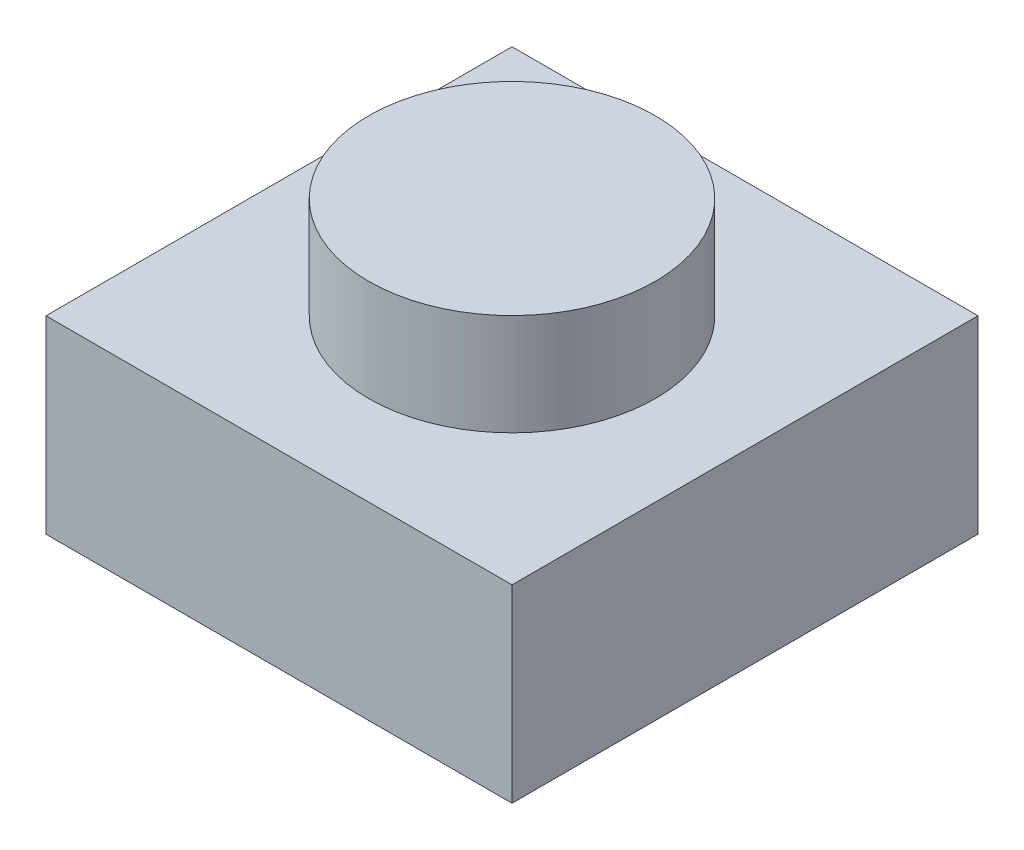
SolidWorks part; units mm, degrees
ref_plane "Front Plane" through (0, 0, 0) normal (0, 0, 1) x (1, 0, 0)
ref_plane "Top Plane" through (0, 0, 0) normal (0, 1, 0) x (1, 0, 0)
ref_plane "Right Plane" through (0, 0, 0) normal (1, 0, 0) x (0, 0, -1)
sketch "Sketch1" plane through (0, 0, 0) normal (0, 1, 0) x (1, 0, 0)
  line L1 (3.9, -3.9) -> (-3.9, -3.9)
  line L2 (3.9, -3.9) -> (3.9, 3.9)
  line L3 (3.9, 3.9) -> (-3.9, 3.9)
  line L4 (-3.9, -3.9) -> (-3.9, 3.9)
  line L5 (3.9, -3.9) -> (-3.9, 3.9) construction
  line L6 (3.9, 3.9) -> (-3.9, -3.9) construction
  point P0 (0, 0)
  dimension "D1" = 7.8
  dimension "D2" = 7.8
extrude "Extrude1" add sketch "Sketch1" along normal blind 3.166
sketch "Sketch2" plane through (0, 3.166, 0) normal (0, 1, 0) x (1, 0, 0)
  circle A0 centre (0, 0) radius 2.4
  dimension "D1" = 4.8
extrude "Extrude2" add sketch "Sketch2" along normal blind 1.7
sketch "Sketch3" plane through (0, 0, 0) normal (0, -1, 0) x (1, 0, 0)
  line L0 (-3.9, 3.9) -> (3.9, 3.9) construction
  line L1 (2.45, -2.45) -> (-2.45, -2.45)
  line L2 (2.45, -2.45) -> (2.45, 2.45)
  line L3 (2.45, 2.45) -> (-2.45, 2.45)
  line L4 (-2.45, -2.45) -> (-2.45, 2.45)
  line L5 (2.45, -2.45) -> (-2.45, 2.45) construction
  line L6 (2.45, 2.45) -> (-2.45, -2.45) construction
  line L7 (3.9, 3.9) -> (3.9, -3.9) construction
  point P0 (0, 0)
  dimension "D1" = 1.45
  dimension "D2" = 1.45
extrude "Extrude3" cut sketch "Sketch3" against normal blind 2.5
